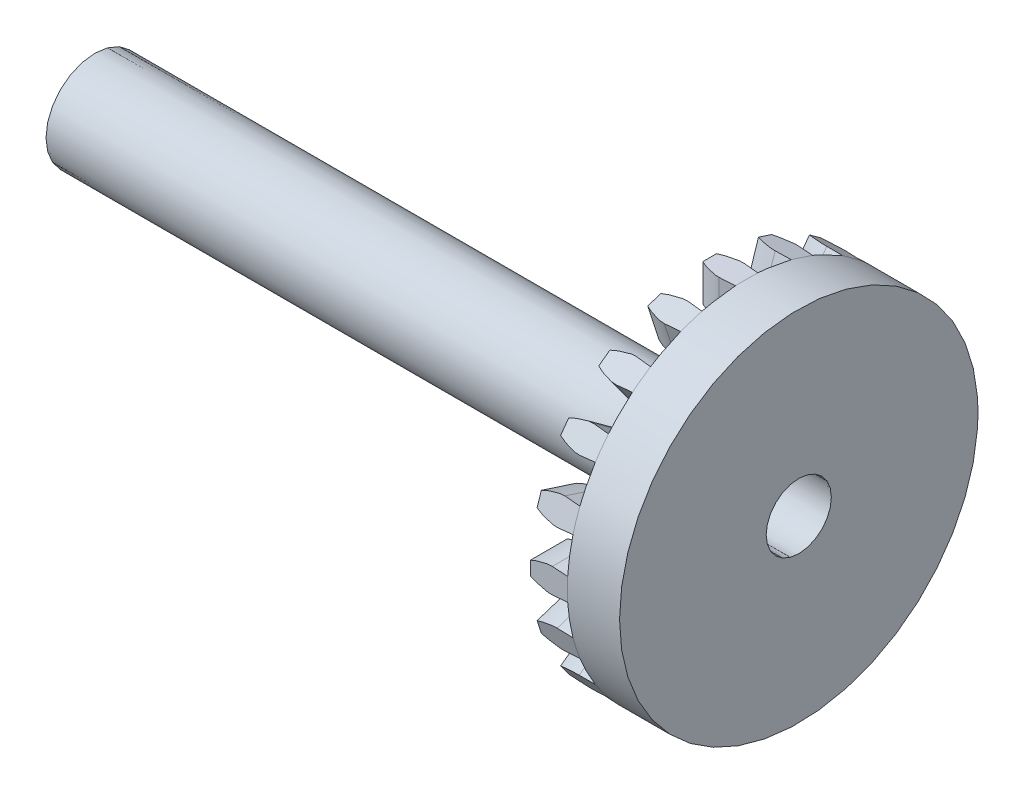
SolidWorks part; units mm, degrees
ref_plane "Front Plane" through (0, 0, 0) normal (0, 0, 1) x (1, 0, 0)
ref_plane "Top Plane" through (0, 0, 0) normal (0, 1, 0) x (1, 0, 0)
ref_plane "Right Plane" through (0, 0, 0) normal (1, 0, 0) x (0, 0, -1)
sketch "Sketch1" plane through (0, 0, 0) normal (0, 1, 0) x (1, 0, 0)
  line L0 (0, 0) -> (0, 2.4204) construction
  line L1 (0, 0) -> (-2.4129, 0.1899) construction
  line L2 (0, 0) -> (-2.75, 0) construction
  line L3 (0, 0) -> (-2.4129, -0.1899) construction
  line L4 (0, 0) -> (-2.3535, -0.565) construction
  circle A0 centre (0, 0) radius 2.5 construction
  circle A1 centre (0, 0) radius 2.4204 construction
  circle A2 centre (0, 0) radius 2.1875 construction
  circle A3 centre (0, 0) radius 2.75 construction
  spline S0 degree 4 poles (-2.4129, 0.1899) (-2.4173, 0.1902) (-2.4297, 0.1908) (-2.4531, 0.19) (-2.4912, 0.1861) (-2.5394, 0.1774) (-2.6007, 0.162) (-2.6717, 0.1385) (-2.7479, 0.1072) (-2.8285, 0.0674) (-2.9065, 0.0227) (-2.9819, -0.0264) (-3.0546, -0.0792) (-3.1397, -0.1476) (-3.2373, -0.2358) (-3.3442, -0.3471) (-3.4567, -0.4828) (-3.5612, -0.6301) (-3.6552, -0.7822) (-3.7397, -0.9431) (-3.8138, -1.1037) (-3.8792, -1.2766) (-3.9337, -1.4393) (-3.9816, -1.6269) (-4.0163, -1.78) (-4.0478, -1.9863) (-4.062, -2.1093) (-4.0736, -2.2544) (-4.0761, -2.3194) (-4.0777, -2.3594) knots 0 0 0 0 0 0.005377 0.015084 0.028532 0.04661 0.064855 0.092111 0.119476 0.146842 0.174209 0.201575 0.228941 0.256307 0.307035 0.361767 0.4165 0.471232 0.525964 0.580697 0.635429 0.690161 0.744894 0.799626 0.854358 0.909091 0.954545 1 1 1 1 1 construction
  spline S1 degree 4 poles (-2.4129, 0.1899) (-2.4173, 0.1902) (-2.4297, 0.1908) (-2.4531, 0.19) (-2.4912, 0.1861) (-2.5394, 0.1774) (-2.6007, 0.162) (-2.6717, 0.1385) (-2.7479, 0.1072) (-2.8285, 0.0674) (-2.9065, 0.0227) (-2.9819, -0.0264) (-3.0546, -0.0792) (-3.1397, -0.1476) (-3.2373, -0.2358) (-3.3442, -0.3471) (-3.4567, -0.4828) (-3.5612, -0.6301) (-3.6552, -0.7822) (-3.7397, -0.9431) (-3.8138, -1.1037) (-3.8792, -1.2766) (-3.9337, -1.4393) (-3.9816, -1.6269) (-4.0163, -1.78) (-4.041, -1.9415) (-4.0513, -2.0206) (-4.0558, -2.0612) knots 0 0 0 0 0 0.005377 0.015084 0.028532 0.04661 0.064855 0.092111 0.119476 0.146842 0.174209 0.201575 0.228941 0.256307 0.307035 0.361767 0.4165 0.471232 0.525964 0.580697 0.635429 0.690161 0.744894 0.799626 0.854358 0.909091 0.909091 0.909091 0.909091 0.909091
  dimension "D1" = 5.5
  dimension "D2" = 5
  dimension "D3" = 4.8407
  dimension "D4" = 4.375
  dimension "D5" = 2.4204
  dimension "D6" = 4.5
  dimension "D7" = 9
  dimension "D8" = 18
sketch "Sketch2" plane through (0, 0, 0) normal (0, 1, 0) x (1, 0, 0)
  line L0 (0, 0) -> (-2.75, 0) construction
  line L1 (0, 0) -> (-2.75, 0) construction
  line L2 (0, 0) -> (-2.4129, -0.1899) construction
  line L3 (0, 0) -> (-2.4129, 0.1899) construction
  line L4 (0, 0) -> (-2.3535, -0.565) construction
  line L5 (0, 0) -> (-2.4129, -0.1899) construction
  line L6 (0, 0) -> (-2.4129, 0.1899) construction
  line L7 (0, 0) -> (-2.3535, -0.565) construction
  line L8 (-2.4129, -0.1899) -> (-2.1808, -0.1716)
  line L9 (-2.1808, -0.1716) -> (-2.1808, 0.1716)
  line L10 (-2.1271, -0.5107) -> (-2.3535, -0.565) construction
  line L11 (-2.1808, 0.1716) -> (-2.4129, 0.1899)
  circle A0 centre (0, 0) radius 2.1875 construction
  circle A1 centre (0, 0) radius 2.4204 construction
  circle A2 centre (0, 0) radius 2.5 construction
  circle A3 centre (0, 0) radius 2.75 construction
  circle A4 centre (0, 0) radius 2.1875 construction
  circle A5 centre (0, 0) radius 2.4204 construction
  circle A6 centre (0, 0) radius 2.5 construction
  circle A7 centre (0, 0) radius 2.75 construction
  arc A8 (-2.748, -0.1058) -> (-2.748, 0.1058) centre (0, 0) cw
  circle A11 centre (0, 0) radius 0.5 construction
  arc A12 (-0.5, 0) -> (-0.4862, -0.1167) centre (0, 0) ccw
  spline S0 degree 4 poles (-112.5658, -993.723) (-2.8903, -16.0404) (-1.6577, -0.1716) (-2.0851, 0.2274) (-2.4912, 0.1861) (-2.5394, 0.1774) (-2.6007, 0.162) (-2.6717, 0.1385) (-2.7479, 0.1072) (-2.8285, 0.0674) (-2.9065, 0.0227) (-2.9819, -0.0264) (-3.0546, -0.0792) (-3.1397, -0.1476) (-3.2373, -0.2358) (-3.3442, -0.3471) (-3.4567, -0.4828) (-3.5612, -0.6301) (-3.6552, -0.7822) (-3.7397, -0.9431) (-3.8138, -1.1037) (-3.8792, -1.2766) (-3.9337, -1.4393) (-3.9816, -1.6269) (-4.1524, -2.379) (-4.2582, -4.9019) (-0.5526, 25.0781) (-114.7277, -995.9119) knots -0.45029 -0.45029 -0.45029 -0.45029 -0.45029 0.005377 0.015084 0.028532 0.04661 0.064855 0.092111 0.119476 0.146842 0.174209 0.201575 0.228941 0.256307 0.307035 0.361767 0.4165 0.471232 0.525964 0.580697 0.635429 0.690161 0.744894 0.799626 0.854358 1.765945 1.765945 1.765945 1.765945 1.765945 only from (-2.4129, 0.1899) to (-4.0558, -2.0612) construction
  spline S1 degree 4 poles (-2.4129, 0.1899) (-2.4173, 0.1902) (-2.4297, 0.1908) (-2.4531, 0.19) (-2.4912, 0.1861) (-2.5394, 0.1774) (-2.6007, 0.162) (-2.6612, 0.142) (-2.7066, 0.124) (-2.7376, 0.1105) (-2.748, 0.1058) knots 0 0 0 0 0 0.005377 0.015084 0.028532 0.04661 0.064855 0.092111 0.10602 0.10602 0.10602 0.10602 0.10602
  spline S2 degree 4 poles (-2.4129, -0.1899) (-2.4173, -0.1902) (-2.4297, -0.1908) (-2.4531, -0.19) (-2.4912, -0.1861) (-2.5394, -0.1774) (-2.6007, -0.162) (-2.6612, -0.142) (-2.7066, -0.124) (-2.7376, -0.1105) (-2.748, -0.1058) knots 0 0 0 0 0 0.005377 0.015084 0.028532 0.04661 0.064855 0.092111 0.10602 0.10602 0.10602 0.10602 0.10602
  point P21 (-2.1808, -0.1716)
  point P24 (-2.1271, -0.5107)
  dimension "D2" = 1
extrude "Boss-Extrude2" add sketch "Sketch2" along normal blind 0.5625 contours L8 L9 L11 S1 A8 S2
sketch "Sketch3" plane through (-2.1808, 0, 0) normal (1, 0, 0) x (0, 0, -1)
  circle A0 centre (0, 2.75) radius 2.75
  dimension "D1" = 5.5
extrude "Boss-Extrude3" add sketch "Sketch3" along normal blind 0.8
sketch "Sketch4" plane through (-2.1808, 0, 0) normal (-1, 0, 0) x (0, 0, 1)
  circle A0 centre (0, 2.75) radius 0.5
  dimension "D1" = 1
extrude "Cut-Extrude1" cut sketch "Sketch4" against normal up to surface (0.8 mm away)
pattern_circular "CirPattern1" count 20 over 360 about axis through (0.0335, 2.75, 0) along (-1, 0, 0) of "Boss-Extrude2"
sketch "Sketch5" plane through (-2.1808, 0, 0) normal (-1, 0, 0) x (0, 0, 1)
  circle A0 centre (0, 2.75) radius 0.5
  circle A1 centre (0, 2.75) radius 0.75
  circle A2 centre (0, 2.75) radius 0.5 construction
  dimension "D1" = 0.25
extrude "Boss-Extrude4" add sketch "Sketch5" along normal blind 10
equation "\"Module\"= .25"
equation "\"Number of Teeth\"= 20"
equation "\"Pressure Angle\"= 14.5deg"
equation "\"Pitch Diameter\"= \"Number of Teeth\" * \"Module\""
equation "\"Circular Pitch\"= pi * \"Module\""
equation "\"Addendum\"= \"Module\""
equation "\"Dedendum\"= 1.25 * \"Module\""
equation "\"Base Diameter\"= \"Pitch Diameter\" * cos ( \"Pressure Angle\" )"
equation "\"Base Radius\"= \"Base Diameter\" / 2"
equation "\"Width\"=0.8"
equation "\"Outside Diameter\"= \"Pitch Diameter\" + 2 * \"Addendum\""
equation "\"D1@Sketch1\"=\"Outside Diameter\""
equation "\"D3@Sketch1\"=\"Base Diameter\""
equation "\"Root Diameter\"= \"Pitch Diameter\" - 2 * \"Dedendum\""
equation "\"D4@Sketch1\"=\"Root Diameter\""
equation "\"Tooth Angle\"= 360 / \"Number of Teeth\""
equation "\"D6@Sketch1\"=\"Tooth Angle\"/4"
equation "\"D7@Sketch1\"=\"Tooth Angle\"/2"
equation "\"D8@Sketch1\"=\"Tooth Angle\""
equation "\"D2@Sketch1\" = \"Pitch Diameter\""
equation "\"Shaft Diameter\"= 1"
equation "\"D2@Sketch2\"= \"Shaft Diameter\""
equation "\"D1@Boss-Extrude3\"=\"Width\""
equation "\"D1@Boss-Extrude2\"=(\"Addendum\"+\"Dedendum\")"
equation "\"D1@Sketch3\"=\"Outside Diameter\""
equation "\"D1@Sketch4\"=\"Shaft Diameter\""
equation "\"D1@CirPattern1\"=\"Number of Teeth\""
